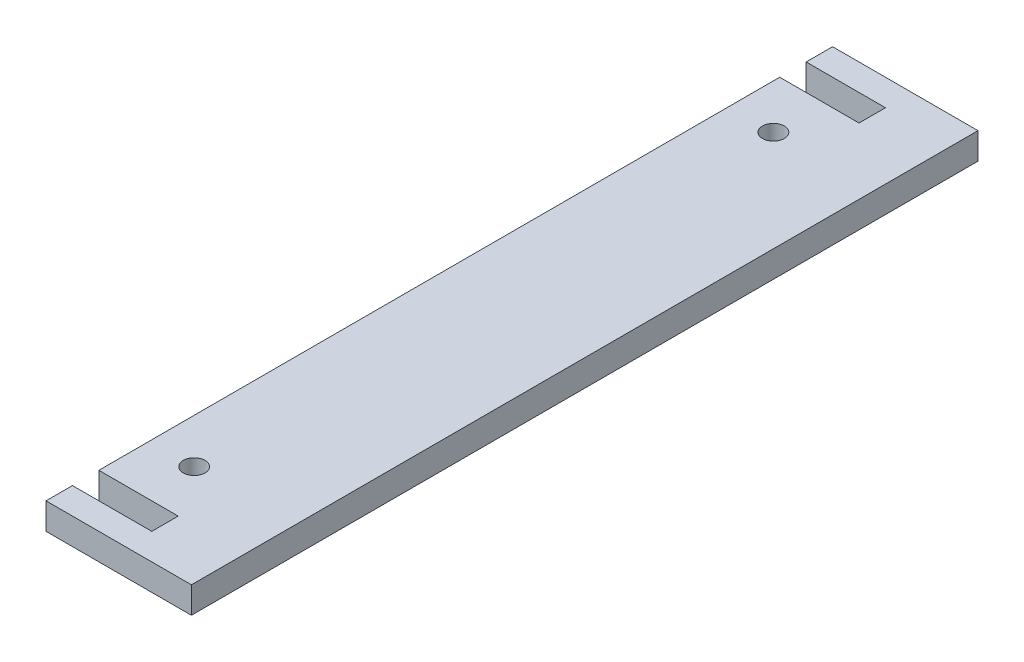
SolidWorks part; units mm, degrees
ref_plane "Front Plane" through (0, 0, 0) normal (0, 0, 1) x (1, 0, 0)
ref_plane "Top Plane" through (0, 0, 0) normal (0, 1, 0) x (1, 0, 0)
ref_plane "Right Plane" through (0, 0, 0) normal (1, 0, 0) x (0, 0, -1)
sketch "Sketch1" plane through (0, 0, 0) normal (0, 1, 0) x (1, 0, 0)
  line L0 (-11, 55.5) -> (-11, 59.5)
  line L1 (-11, -59.5) -> (11, -59.5)
  line L2 (-11, -59.5) -> (-11, -55.5)
  line L3 (-11, 59.5) -> (11, 59.5)
  line L4 (11, -59.5) -> (11, 59.5)
  line L5 (-11, -59.5) -> (11, 59.5) construction
  line L6 (-11, 59.5) -> (11, -59.5) construction
  line L7 (-11, 55.5) -> (1, 55.5)
  line L8 (-11, -51.5) -> (-11, 51.5)
  line L9 (-11, 51.5) -> (1, 51.5)
  line L10 (1, 55.5) -> (1, 51.5)
  line L11 (-11, -55.5) -> (1, -55.5)
  line L13 (-11, -51.5) -> (1, -51.5)
  line L14 (1, -55.5) -> (1, -51.5)
  circle A0 centre (-4.27, 43.815) radius 1.65
  circle A1 centre (-4.27, -43.815) radius 1.65
  point P0 (0, 0)
  dimension "D9" = 15.27
  dimension "D1" = 22
  dimension "D2" = 119
  dimension "D3" = 4
  dimension "D4" = 4
  dimension "D5" = 4
  dimension "D6" = 4
  dimension "D7" = 12
  dimension "D8" = 12
  dimension "D10" = 15.27
  dimension "D11" = 87.63
  dimension "D12" = 15.685
extrude "Extrude1" add sketch "Sketch1" along normal blind 4
